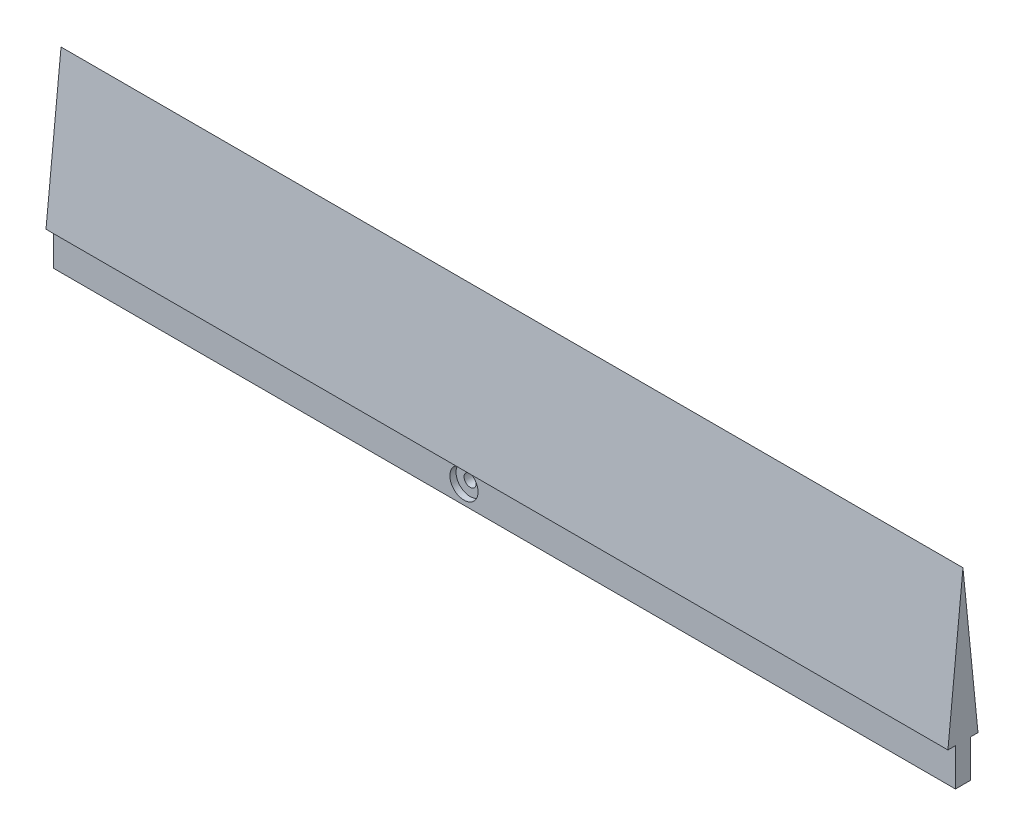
SolidWorks part; units mm, degrees
ref_plane "Front Plane" through (0, 0, 0) normal (0, 0, 1) x (1, 0, 0)
ref_plane "Top Plane" through (0, 0, 0) normal (0, 1, 0) x (1, 0, 0)
ref_plane "Right Plane" through (0, 0, 0) normal (1, 0, 0) x (0, 0, -1)
sketch "Sketch1" plane through (0, 0, 0) normal (1, 0, 0) x (0, 0, -1)
  line L0 (0, 76.6126) -> (0, -50.704) construction
  line L1 (-1.27, 0) -> (1.27, 0)
  line L2 (1.27, 0) -> (1.27, 6.35)
  line L3 (1.27, 6.35) -> (2.54, 6.35)
  line L4 (2.54, 6.35) -> (0, 31.75)
  line L5 (-1.27, 0) -> (-1.27, 6.35)
  line L6 (-1.27, 6.35) -> (-2.54, 6.35)
  line L7 (-2.54, 6.35) -> (0, 31.75)
  point P9 (0, 0)
  dimension "D1" = 2.54
  dimension "D2" = 1.27
  dimension "D3" = 25.4
  dimension "D4" = 6.35
extrude "Extrude1" add sketch "Sketch1" along normal blind 152.4
sketch "Sketch2" plane through (0, 0, 1.27) normal (0, 0, 1) x (1, 0, 0)
  point P0 (69.3539, 3.136)
hole_wizard "CBORE for #1 Binding Head Machine Screw1" positions "3DSketch1" profile "Sketch3" counterbore size "#1" standard "Ansi Inch"
sketch3d "3DSketch1"
  point P0 (69.3539, 3.136, 1.27)
sketch "Sketch3" plane through (69.3539, 3.136, 1.27) normal (1, 0, 0) x (0, -1, 0)
  line L0 (0, 0) -> (0, 3.81)
  line L1 (0, 3.81) -> (1.0287, 3.81)
  line L3 (1.0287, 3.81) -> (1.0287, 1.0414)
  line L4 (1.0287, 1.0414) -> (2.3812, 1.0414)
  line L5 (2.3812, 1.0414) -> (2.3812, 0)
  line L7 (2.3812, 0) -> (0, 0)
  line L11 (0, -6.35) -> (0, 107.95) construction
  dimension "Thru Hole Dia." = 2.0574
  dimension "Thru Hole Depth" = 3.81
  dimension "C'Bore Dia." = 4.7625
  dimension "C'Bore Depth" = 1.0414
